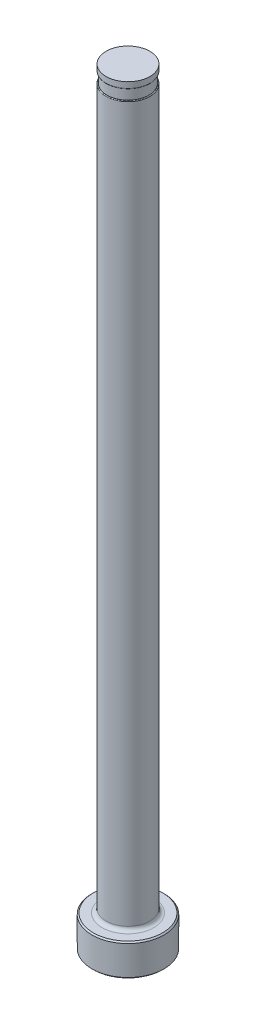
SolidWorks part; units mm, degrees
ref_plane "Front Plane" through (0, 0, 0) normal (0, 0, 1) x (1, 0, 0)
ref_plane "Top Plane" through (0, 0, 0) normal (0, 1, 0) x (1, 0, 0)
ref_plane "Right Plane" through (0, 0, 0) normal (1, 0, 0) x (0, 0, -1)
other "Configuration Table"
sketch "Sketch1" plane through (0, 0, 0) normal (0, 0, 1) x (1, 0, 0)
  line L0 (0, 259.9588) -> (0, -15.1925) construction
  line L1 (0, 0) -> (-7.1374, 0)
  line L2 (-7.1374, 0) -> (-7.1374, 6.35)
  line L3 (-7.1374, 6.35) -> (-4.365, 6.35)
  line L4 (-4.365, 6.35) -> (-4.365, 152.4)
  line L5 (-4.365, 152.4) -> (0, 152.4)
  line L6 (0, 152.4) -> (0, 0)
  dimension "L" = 152.4
  dimension "H" = 14.2748
  dimension "T" = 6.35
  dimension "D" = 8.73
revolve "Revolve1" add sketch "Sketch1" angle 360 about L0
chamfer "Chamfer1" distance 0.254 angle 45 2 edges at (0, 6.35, 7.1374) (0, 0, 7.1374)
fillet "Fillet1" radius 0.762 1 edges at (0, 6.35, 4.365)
sketch "Sketch2" plane through (0, 0, 0) normal (0, 0, 1) x (1, 0, 0)
  line L0 (-4.365, 152.4) -> (-4.365, 7.112) construction
  line L1 (-4.365, 151.13) -> (-4.1618, 151.13)
  line L2 (-4.365, 151.13) -> (-4.365, 149.098)
  line L3 (-4.365, 149.098) -> (-4.1618, 149.098)
  line L4 (-4.1618, 151.13) -> (-4.1618, 149.098)
  line L5 (4.365, 152.4) -> (-4.365, 152.4) construction
  line L6 (0, 153.4483) -> (0, 147.3282) construction
  dimension "D1" = 2.032
  dimension "N" = 1.27
  dimension "FD" = 0.2032
  dimension "D3" = 8.3236
revolve "Vent Relief" cut sketch "Sketch2" angle 360 about L6
sketch "Sketch3" plane through (0, 0, 0) normal (0, 0, 1) x (1, 0, 0)
  line L0 (-4.1618, 150.114) -> (-4.1618, 86.614)
  line L1 (-4.1618, 151.13) -> (-4.1618, 149.098) construction
  line L2 (-4.365, 149.098) -> (-4.365, 7.112) construction
  line L3 (-4.365, 85.4964) -> (-4.365, 150.114)
  line L4 (-4.365, 150.114) -> (-4.1618, 150.114)
  arc A0 (-4.1618, 86.614) -> (-4.365, 85.4964) centre (-7.3368, 86.614) cw
  dimension "D1" = 3.175
  dimension "D2" = 63.5
extrude "D-Slot" cut sketch "Sketch3" against normal through all both and the other way through all
sketch "Sketch5" plane through (0, 0, 0) normal (0, 0, 1) x (1, 0, 0)
  line L0 (-4.365, 151.13) -> (4.365, 151.13) construction
  line L1 (-4.365, 152.4) -> (-4.3523, 152.4)
  line L2 (-4.365, 152.4) -> (-4.365, 151.13)
  line L3 (-4.365, 151.13) -> (-4.3523, 151.13)
  line L4 (-4.3523, 152.4) -> (-4.3523, 151.13)
  line L5 (0, 152.6877) -> (0, 150.5771) construction
  dimension "VP" = 0.0127
revolve "Vent Diameter" cut sketch "Sketch5" angle 360 about L5
fillet "Fillet2" radius 0.127 2 edges at (4.365, 149.098, 0) (0, 151.13, 4.3523)
sketch "Pocket Sketch" plane through (0, 0, 0) normal (0, 0, 1) x (1, 0, 0)
  line L0 (-7.5343, 0) -> (-7.5343, 6.3754)
  line L1 (-7.5343, 6.3754) -> (-5.3254, 6.3754)
  line L2 (-4.5634, 7.1374) -> (-4.5634, 22.225)
  line L3 (-4.5634, 22.225) -> (0, 22.225)
  line L4 (0, 22.225) -> (0, 0)
  line L5 (0, 0) -> (-7.5343, 0)
  line L6 (0, 12.6104) -> (0, -2.4989) construction
  line L7 (-7.1374, 6.096) -> (-7.1374, 0.254) construction
  line L8 (6.8834, 6.35) -> (-6.8834, 6.35) construction
  line L9 (-4.365, 85.4964) -> (-4.365, 7.112) construction
  line L10 (-5.3254, 6.3754) -> (-4.5634, 7.1374)
  point P3 (-4.5634, 6.3754)
  dimension "D1" = 15.0685
  dimension "D2" = 0.3969
  dimension "D3" = 0.0254
  dimension "D4" = 0.1984
  dimension "D5" = 9.1269
  dimension "D6" = 22.225
